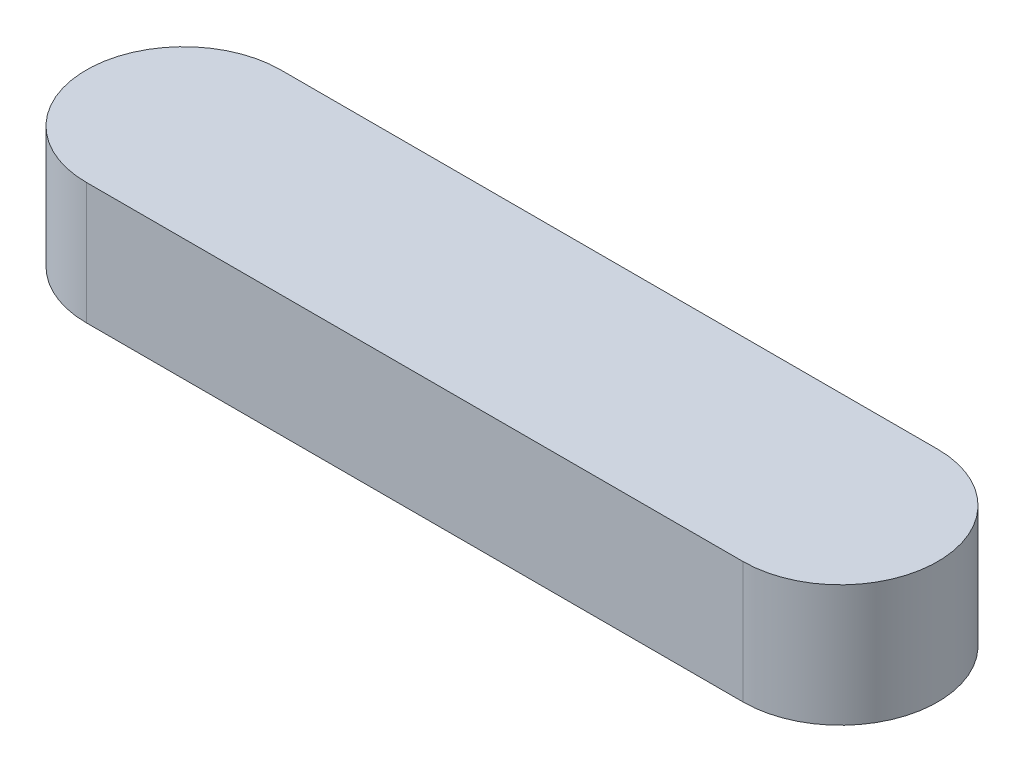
SolidWorks part; units mm, degrees
ref_plane "Спереди" through (0, 0, 0) normal (0, 0, 1) x (1, 0, 0)
ref_plane "Сверху" through (0, 0, 0) normal (0, 1, 0) x (1, 0, 0)
ref_plane "Справа" through (0, 0, 0) normal (1, 0, 0) x (0, 0, -1)
sketch "Sketch1" plane through (0, 0, 0) normal (0, 1, 0) x (1, 0, 0)
  line L0 (107.7099, 0) -> (-89.2202, 0) construction
  line L1 (54, 8) -> (0, 8)
  line L2 (0, -8) -> (54, -8)
  arc A0 (0, 8) -> (0, -8) centre (0, 0) ccw
  arc A1 (54, -8) -> (54, 8) centre (54, 0) ccw
  point P4 (-8, 0)
  point P6 (62, 0)
  dimension "D1" = 8
  dimension "D2" = 70
extrude "Extrude1" add sketch "Sketch1" along normal blind 10
